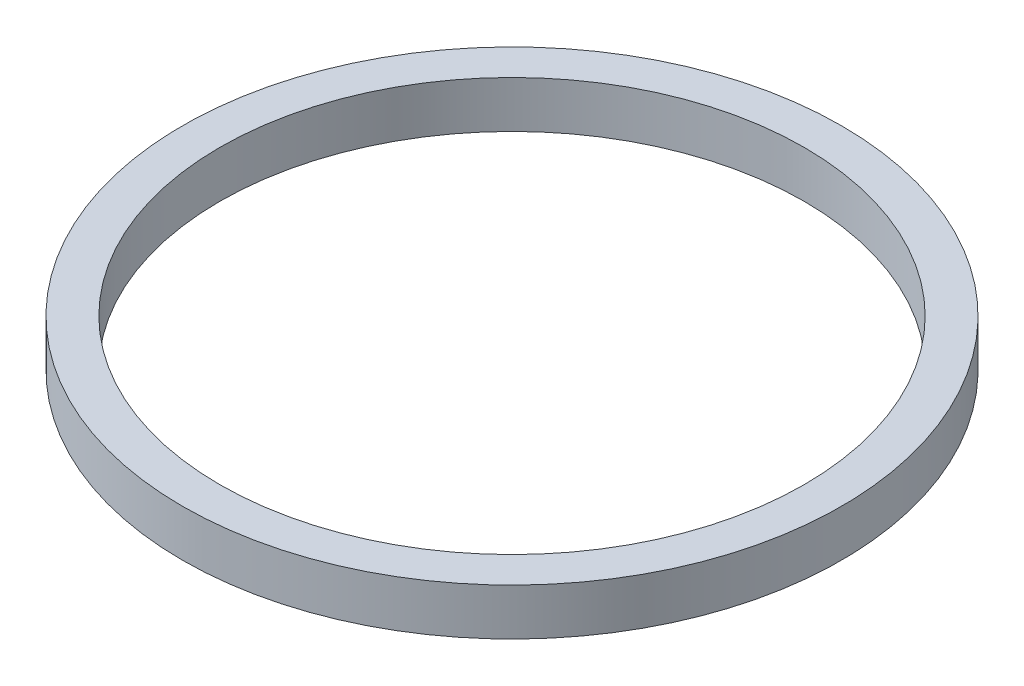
SolidWorks part; units mm, degrees
ref_plane "Front Plane" through (0, 0, 0) normal (0, 0, 1) x (1, 0, 0)
ref_plane "Top Plane" through (0, 0, 0) normal (0, 1, 0) x (1, 0, 0)
ref_plane "Right Plane" through (0, 0, 0) normal (1, 0, 0) x (0, 0, -1)
sketch "Sketch1" plane through (0, 0, 0) normal (0, 1, 0) x (1, 0, 0)
  circle A0 centre (0, 0) radius 14.1
  dimension "D1" = 28.2
extrude "Boss-Extrude1" add sketch "Sketch1" along normal blind 2
sketch "Sketch2" plane through (0, 2, 0) normal (0, 1, 0) x (1, 0, 0)
  circle A0 centre (0, 0) radius 12.5
  dimension "D1" = 25
extrude "Cut-Extrude1" cut sketch "Sketch2" against normal through all
